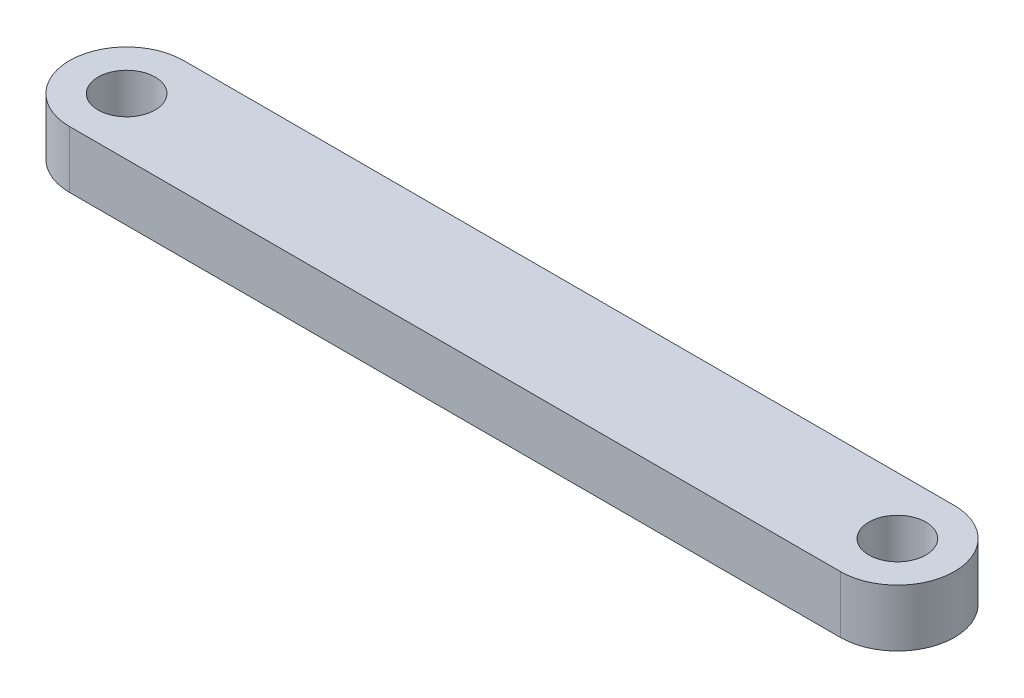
SolidWorks part; units mm, degrees
ref_plane "Front Plane" through (0, 0, 0) normal (0, 0, 1) x (1, 0, 0)
ref_plane "Top Plane" through (0, 0, 0) normal (0, 1, 0) x (1, 0, 0)
ref_plane "Right Plane" through (0, 0, 0) normal (1, 0, 0) x (0, 0, -1)
sketch "Sketch1" plane through (0, 0, 0) normal (0, 1, 0) x (1, 0, 0)
  line L0 (-675, 0) -> (675, 0) construction
  line L1 (-675, 100) -> (675, 100)
  line L2 (-675, -100) -> (675, -100)
  arc A0 (-675, 100) -> (-675, -100) centre (-675, 0) ccw
  arc A1 (675, -100) -> (675, 100) centre (675, 0) ccw
  circle A2 centre (-675, 0) radius 50
  circle A3 centre (675, 0) radius 50
  point P2 (0, 0)
  dimension "D2" = 100
  dimension "D3" = 100
  dimension "D4" = 100
  dimension "D1" = 1350
extrude "Boss-Extrude1" add sketch "Sketch1" along normal mid plane 100
